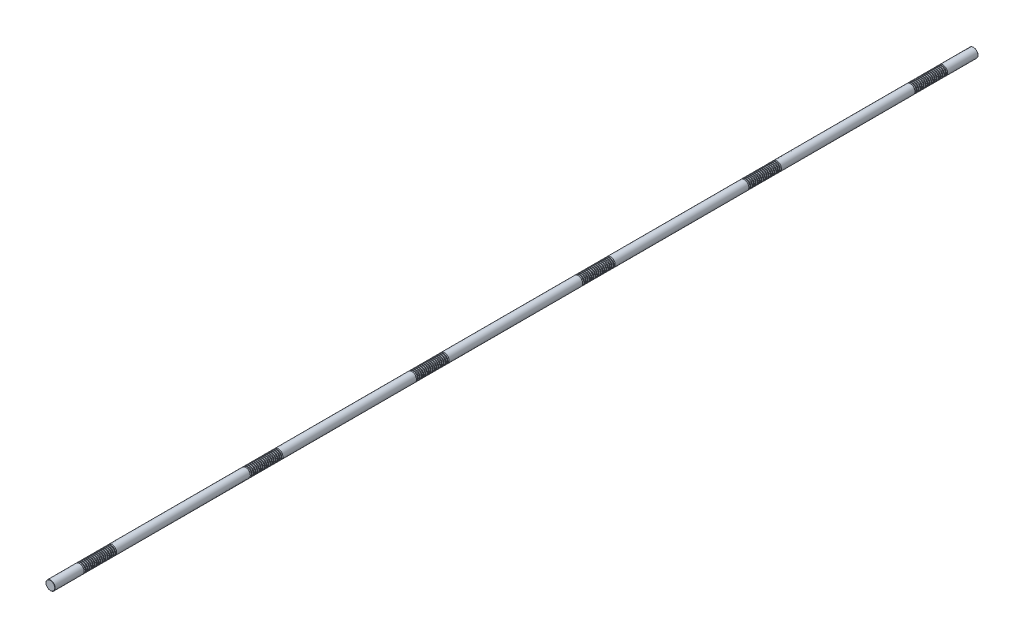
SolidWorks part; units mm, degrees
ref_plane "Front Plane" through (0, 0, 0) normal (0, 0, 1) x (1, 0, 0)
ref_plane "Top Plane" through (0, 0, 0) normal (0, 1, 0) x (1, 0, 0)
ref_plane "Right Plane" through (0, 0, 0) normal (1, 0, 0) x (0, 0, -1)
sketch "Sketch1" plane through (0, 0, 0) normal (0, 0, 1) x (1, 0, 0)
  circle A0 centre (0, 0) radius 15
  dimension "D1" = 30
extrude "Boss-Extrude1" add sketch "Sketch1" along normal mid plane 3000
chamfer "Chamfer1" distance 0.75 angle 45 2 edges at (15, 0, -1500) (15, 0, 1500)
sketch "Sketch2" plane through (0, 0, 0) normal (1, 0, 0) x (0, 0, -1)
  line L0 (1400.4689, 15) -> (1396.5311, 15)
  line L1 (1499.25, 15) -> (-1499.25, 15) construction
  line L2 (1396.5311, 15) -> (1397.4689, 11.5)
  line L3 (1397.4689, 11.5) -> (1399.5311, 11.5)
  line L4 (1399.5311, 11.5) -> (1400.4689, 15)
  line L5 (1500, -14.25) -> (1500, 14.25) construction
  point P4 (1398.5, 15)
  point P7 (1398.5, 11.5)
  point P8 (1400, 13.25)
  point P9 (1397, 13.25)
  dimension "D1" = 3
  dimension "D2" = 100
  dimension "D3" = 3.5
  dimension "D4" = 30
revolve "Cut-Revolve1" cut sketch "Sketch2" angle 360 about axis through (0, 0, 1500) along (0, 0, -1)
pattern_linear "LPattern1" count 18 spacing 6 along (0, 0, 1) of "Cut-Revolve1"
pattern_linear "LPattern2" count 6 spacing 540 along (0, 0, 1) of "Cut-Revolve1", "LPattern1"
